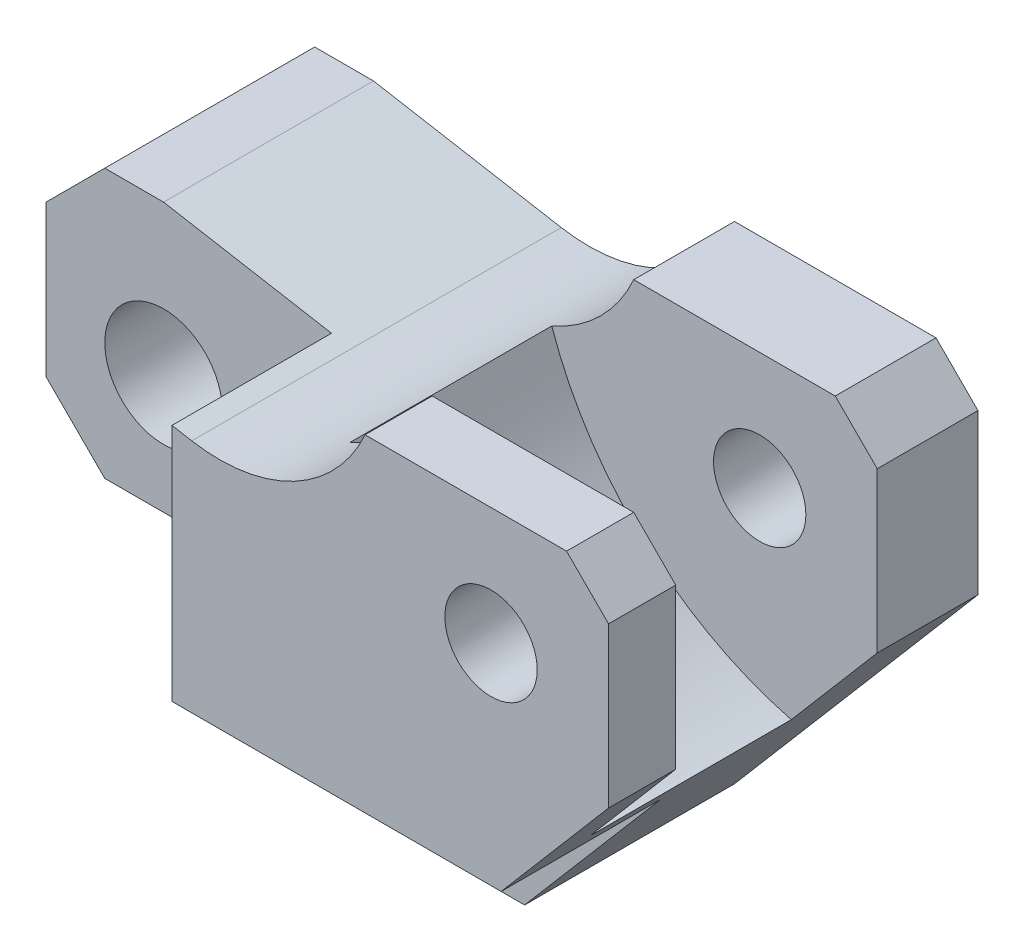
SolidWorks part; units mm, degrees
ref_plane "Front Plane" through (0, 0, 0) normal (0, 0, 1) x (1, 0, 0)
ref_plane "Top Plane" through (0, 0, 0) normal (0, 1, 0) x (1, 0, 0)
ref_plane "Right Plane" through (0, 0, 0) normal (1, 0, 0) x (0, 0, -1)
sketch "Esquisse1" plane through (0, 0, 0) normal (0, 0, 1) x (1, 0, 0)
  line L0 (15.5021, 28.6255) -> (39.5021, 28.6255)
  line L1 (39.5021, 28.6255) -> (44.5021, 23.6255)
  line L2 (44.5021, 23.6255) -> (44.5021, 4.6255)
  line L3 (44.5021, 4.6255) -> (15.5021, -29.3745)
  line L4 (15.5021, -29.3745) -> (9.7991, -29.3745)
  line L5 (-1.9223, -10.3745) -> (-34.4979, -10.3745)
  line L6 (-34.4979, -10.3745) -> (-41.4979, -3.3745)
  line L7 (-41.4979, -3.3745) -> (-41.4979, 14.6255)
  line L8 (-41.4979, 14.6255) -> (-34.4979, 21.6255)
  line L9 (-34.4979, 21.6255) -> (-27.4979, 21.6255)
  line L10 (-27.4979, 21.6255) -> (-5.1365, 17.6826)
  arc A0 (9.7991, -29.3745) -> (3.0233, -14.6392) centre (31.708, -10.3745) cw
  arc A1 (3.0233, -14.6392) -> (-1.9223, -10.3745) centre (-1.9223, -15.3745) ccw
  arc A2 (-5.1365, 17.6826) -> (15.5021, 28.6255) centre (-1.8372, 36.394) ccw
  circle A3 centre (-27.4979, 3.6255) radius 7
  dimension "D5" = 29
  dimension "D15" = 5
  dimension "D19" = 19
  dimension "D20" = 14
  dimension "D1" = 29
  dimension "D2" = 135
  dimension "D3" = 5
  dimension "D4" = 24
  dimension "D6" = 19
  dimension "D7" = 29
  dimension "D8" = 86
  dimension "D9" = 7
  dimension "D10" = 32
  dimension "D11" = 135
  dimension "D12" = 7
  dimension "D13" = 14
  dimension "D14" = 190
  dimension "D16" = 58
  dimension "D17" = 14
  dimension "D18" = 14
  dimension "D21" = 19
  dimension "D22" = 135
extrude "Boss.-Extru.1" add sketch "Esquisse1" along normal blind 44
sketch "Esquisse2" plane through (0, 0, 44) normal (0, 0, 1) x (1, 0, 0)
  line L0 (-7.4979, 18.099) -> (-7.4979, -10.3745)
  line L1 (-5.1365, 17.6826) -> (-27.4979, 21.6255) construction
  line L2 (-34.4979, -10.3745) -> (-1.9223, -10.3745) construction
  line L3 (-7.4979, -10.3745) -> (44.5021, -10.3745)
  line L4 (44.5021, -10.3745) -> (44.5021, -36.7937)
  line L5 (44.5021, -36.7937) -> (-46.0538, -36.7937)
  line L6 (-46.0538, -36.7937) -> (-46.0538, 29.5795)
  line L7 (-46.0538, 29.5795) -> (-7.4979, 29.5795)
  line L8 (-7.4979, 29.5795) -> (-7.4979, 18.099)
  dimension "D1" = 52
extrude "Enlèv. mat.-Extru.1" cut sketch "Esquisse2" against normal blind 19
sketch "Esquisse4" plane through (0, 0, 0) normal (0, 0, -1) x (-1, 0, 0)
  line L5 (-15.5021, -29.3745) -> (-44.5021, 4.6255) construction
  line L17 (-15.5021, 28.6255) -> (-39.5021, 28.6255)
  line L18 (-39.5021, 28.6255) -> (-44.5021, 23.6255)
  line L19 (-44.5021, 23.6255) -> (-44.5021, 4.6255)
  line L20 (-44.5021, 4.6255) -> (-15.5021, -29.3745)
  line L21 (-15.5021, -29.3745) -> (-9.7991, -29.3745)
  line L22 (1.9223, -10.3745) -> (34.4979, -10.3745)
  line L23 (34.4979, -10.3745) -> (41.4979, -3.3745)
  line L24 (41.4979, -3.3745) -> (41.4979, 14.6255)
  line L25 (41.4979, 14.6255) -> (34.4979, 21.6255)
  line L26 (34.4979, 21.6255) -> (27.4979, 21.6255)
  line L27 (27.4979, 21.6255) -> (5.1365, 17.6826)
  line L28 (-15.5021, 28.6255) -> (-39.5021, 28.6255)
  line L29 (-39.5021, 28.6255) -> (-44.5021, 23.6255)
  line L30 (-44.5021, 23.6255) -> (-44.5021, 4.6255)
  line L31 (-44.5021, 4.6255) -> (-34.2668, -7.3745)
  arc A2 (-5.7391, 18.9698) -> (-34.2668, -7.3745) centre (-44.5021, 32.3274) cw
  arc A6 (-15.5021, 28.6255) -> (5.1365, 17.6826) centre (1.8372, 36.394) ccw
  arc A7 (-9.7991, -29.3745) -> (-3.0233, -14.6392) centre (-31.708, -10.3745) ccw
  arc A8 (1.9223, -10.3745) -> (-3.0233, -14.6392) centre (1.9223, -15.3745) ccw
  arc A9 (-15.5021, 28.6255) -> (-5.7391, 18.9698) centre (1.8372, 36.394) ccw
  dimension "D1" = 41
  dimension "D2" = 36
  dimension "D3" = 0
extrude "Enlèv. mat.-Extru.2" cut sketch "Esquisse4" against normal blind 24 from offset 12
sketch "Esquisse5" plane through (0, 0, 44) normal (0, 0, 1) x (1, 0, 0)
  line L0 (39.5021, 28.6255) -> (15.5021, 28.6255) construction
  line L1 (44.5021, 4.6255) -> (44.5021, 23.6255) construction
  circle A0 centre (30.5021, 14.6255) radius 5.5
  dimension "D1" = 11
  dimension "D2" = 14
  dimension "D3" = 14
extrude "Enlèv. mat.-Extru.3" cut sketch "Esquisse5" against normal blind 90 and the other way blind 63
